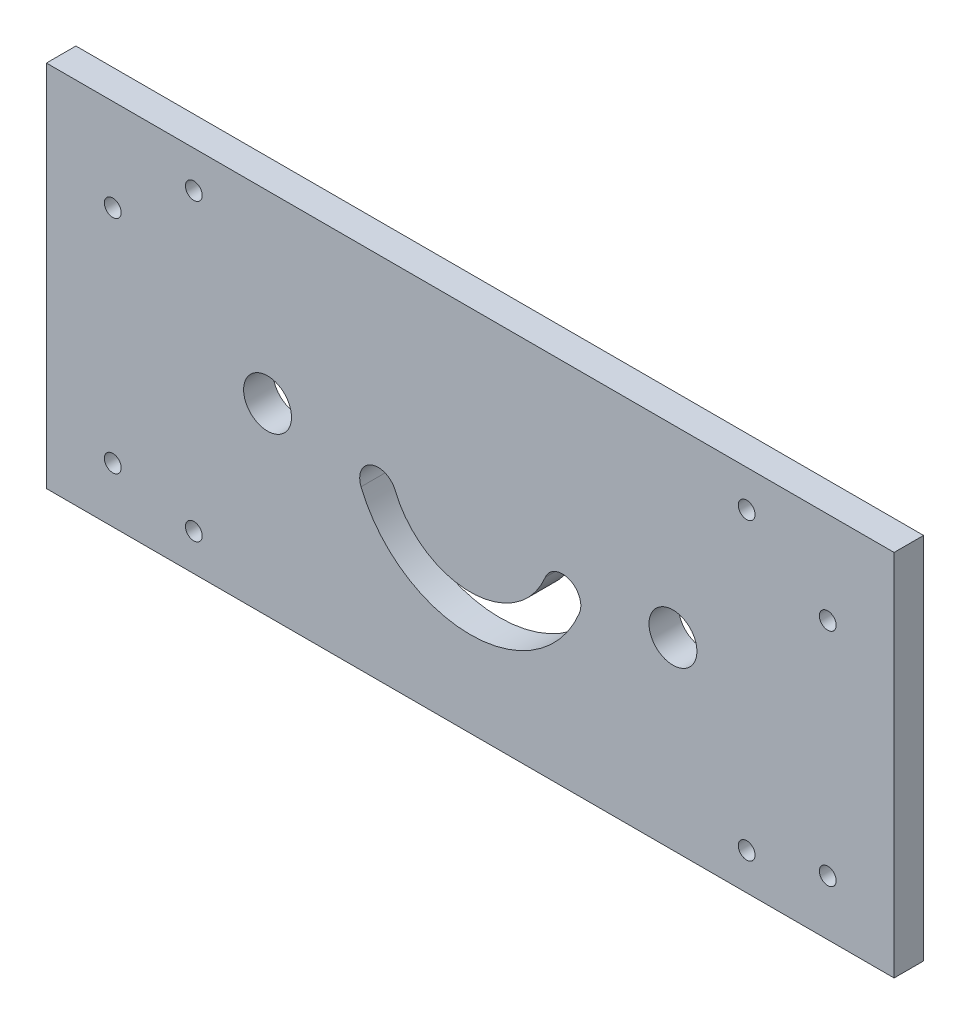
SolidWorks part; units mm, degrees
ref_plane "Front Plane" through (0, 0, 0) normal (0, 0, 1) x (1, 0, 0)
ref_plane "Top Plane" through (0, 0, 0) normal (0, 1, 0) x (1, 0, 0)
ref_plane "Right Plane" through (0, 0, 0) normal (1, 0, 0) x (0, 0, -1)
sketch "Sketch1" plane through (0, 0, 0) normal (0, 0, 1) x (1, 0, 0)
  line L0 (-139.859, 0) -> (143.75, 0) construction
  line L1 (0, 107.7585) -> (0, -112.9464) construction
  line L2 (-115, 50) -> (-115, -50)
  line L3 (-115, -50) -> (115, -50)
  line L4 (115, -50) -> (115, 50)
  line L5 (115, 50) -> (-115, 50)
  line L6 (-139.859, -40) -> (149.1284, -40) construction
  line L7 (-139.859, 40) -> (149.1284, 40) construction
  line L8 (-97, 62.4638) -> (-97, -78.8465) construction
  line L9 (97, 62.4638) -> (97, -78.8465) construction
  line L10 (-135.5109, 25) -> (143.75, 25) construction
  line L11 (-135.5109, -35) -> (149.1284, -35) construction
  line L12 (-75, 66.8683) -> (-75, -72.0562) construction
  line L13 (75, 66.8683) -> (75, -72.0562) construction
  line L14 (-55, 25) -> (-55, -35) construction
  line L15 (-25, 25) -> (-25, -35) construction
  line L16 (25, 25) -> (25, -35) construction
  circle A0 centre (-97, 25) radius 2.285
  circle A1 centre (-97, -35) radius 2.285
  circle A2 centre (-75, -40) radius 2.285
  circle A3 centre (75, -40) radius 2.285
  circle A4 centre (97, -35) radius 2.285
  circle A5 centre (97, 25) radius 2.285
  circle A6 centre (75, 40) radius 2.285
  circle A7 centre (-75, 40) radius 2.285
  circle A8 centre (-55, 0) radius 6.5
  circle A9 centre (55, 0) radius 6.5
  arc A10 (-25, -5) -> (25, -5.0368) centre (0.0075, 5.1796) ccw construction
  arc A11 (-29.631, -6.8851) -> (29.6282, -6.9287) centre (0.0075, 5.1796) ccw
  arc A12 (-20.369, -3.1149) -> (20.3718, -3.1449) centre (0.0075, 5.1796) ccw
  arc A13 (-20.369, -3.1149) -> (-29.631, -6.8851) centre (-25, -5) ccw
  arc A14 (29.6282, -6.9287) -> (20.3718, -3.1449) centre (25, -5.0368) ccw
  point P7 (0, -50)
  point P10 (115, 0)
  point P27 (-97, -35)
  point P28 (-75, -40)
  point P32 (-97, 25)
  point P33 (97, -35)
  point P34 (97, 25)
  point P61 (-0.0124, -21.8204)
  dimension "D7" = 4.57
  dimension "D8" = 4.57
  dimension "D9" = 4.57
  dimension "D12" = 13
  dimension "D14" = 5
  dimension "D15" = 32
  dimension "D1" = 230
  dimension "D2" = 100
  dimension "D3" = 10
  dimension "D4" = 18
  dimension "D5" = 25
  dimension "D6" = 15
  dimension "D10" = 40
  dimension "D11" = 60
  dimension "D13" = 25
extrude "Boss-Extrude1" add sketch "Sketch1" along normal blind 8
